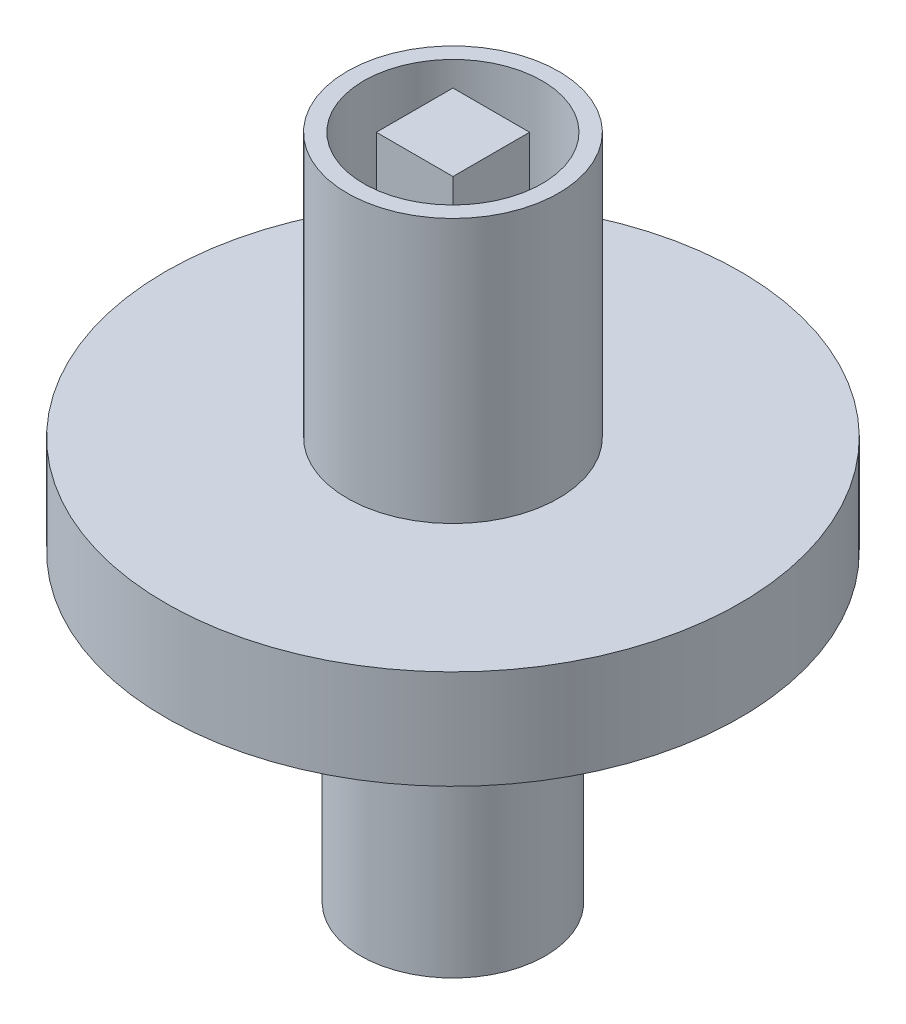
SolidWorks part; units mm, degrees
ref_plane "Front Plane" through (0, 0, 0) normal (0, 0, 1) x (1, 0, 0)
ref_plane "Top Plane" through (0, 0, 0) normal (0, 1, 0) x (1, 0, 0)
ref_plane "Right Plane" through (0, 0, 0) normal (1, 0, 0) x (0, 0, -1)
sketch "Sketch1" plane through (0, 0, 0) normal (0, 0, 1) x (1, 0, 0)
  line L0 (0, 96.2797) -> (0, -99.3784) construction
  line L1 (-49.1359, 0) -> (108.8957, 0) construction
sketch "Sketch2" plane through (0, 0, 0) normal (0, 0, 1) x (1, 0, 0)
  line L0 (-49.1359, 0) -> (108.8957, 0) construction
  line L1 (21.75, 0) -> (21.75, 7.5)
  line L2 (21.75, 7.5) -> (8, 7.5)
  line L3 (8, 7.5) -> (8, 27.5)
  line L4 (8, 27.5) -> (0, 27.5)
  line L5 (0, 96.2797) -> (0, -99.3784) construction
  line L6 (0, 27.5) -> (0, 0)
  line L7 (0, 0) -> (21.75, 0)
revolve "Revolve2" add sketch "Sketch2" angle 360 about L0
sketch "Sketch3" plane through (0, 27.5, 0) normal (0, 1, 0) x (1, 0, 0)
  circle A0 centre (0, 0) radius 6.75
  dimension "D1" = 13.5
extrude "Cut-Extrude1" cut sketch "Sketch3" against normal blind 15 contours A0
sketch "Sketch4" plane through (0, 12.5, 0) normal (0, 1, 0) x (1, 0, 0)
  line L1 (-2.8952, 2.8974) -> (2.9048, 2.8974)
  line L2 (-2.8952, 2.8974) -> (-2.8952, -2.9026)
  line L3 (-2.8952, -2.9026) -> (2.9048, -2.9026)
  line L4 (2.9048, 2.8974) -> (2.9048, -2.9026)
  point P4 (0, 0)
  point P6 (0.0048, -0.0026)
  point P7 (0, 0)
  point P9 (0, 0)
extrude "Boss-Extrude1" add sketch "Sketch4" along normal blind 15
sketch "Sketch6" plane through (0, 0, 0) normal (0, -1, 0) x (1, 0, 0)
  circle A0 centre (0, 0) radius 7
  dimension "D1" = 14
extrude "Boss-Extrude2" add sketch "Sketch6" along normal blind 23
sketch "Sketch7" plane through (0, -23, 0) normal (0, -1, 0) x (1, 0, 0)
  circle A0 centre (0, 0) radius 3.5
  dimension "D1" = 7
extrude "Cut-Extrude2" cut sketch "Sketch7" against normal blind 15
sketch "Sketch8" plane through (0, -23, 0) normal (0, -1, 0) x (1, 0, 0)
  line L4 (-5.3, 1.5) -> (-1.5, 1.5)
  line L5 (-5.3, 1.5) -> (-5.3, -1.5)
  line L6 (5.3, 1.5) -> (5.3, -1.5)
  line L7 (-5.3, -1.5) -> (-1.5, -1.5)
  line L8 (-1.5, -5.3) -> (-1.5, -1.5)
  line L9 (-1.5, -5.3) -> (1.5, -5.3)
  line L10 (-1.5, 5.3) -> (1.5, 5.3)
  line L11 (1.5, -5.3) -> (1.5, -1.5)
  line L12 (1.5, 1.5) -> (5.3, 1.5)
  line L13 (1.5, 1.5) -> (1.5, 5.3)
  line L14 (1.5, -1.5) -> (5.3, -1.5)
  line L15 (-1.5, 1.5) -> (-1.5, 5.3)
  point P1 (0, 0)
  point P2 (0, 0)
  point P3 (0, 0)
  dimension "D1" = 10.6
  dimension "D2" = 3
  dimension "D3" = 10.6
  dimension "D4" = 3
extrude "Cut-Extrude3" cut sketch "Sketch8" against normal blind 15
equation "\"D1@Sketch2\"=43.5/2"
